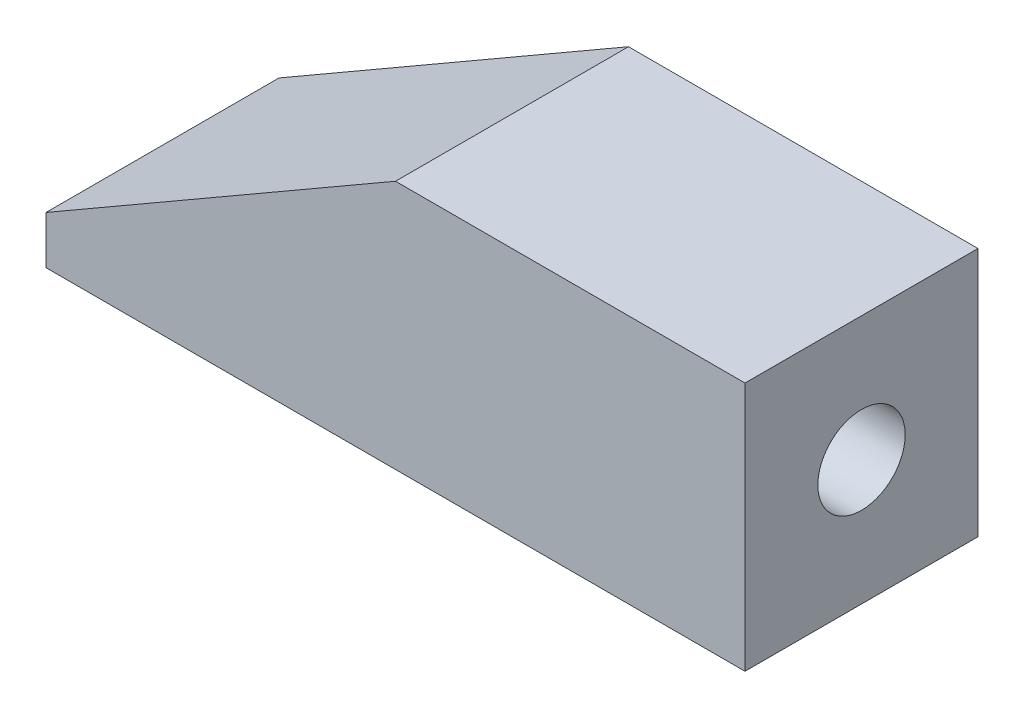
SolidWorks part; units mm, degrees
ref_plane "Plan1" through (0, 0, 0) normal (0, 0, 1) x (1, 0, 0)
ref_plane "Plan2" through (0, 0, 0) normal (0, 1, 0) x (1, 0, 0)
ref_plane "Plan3" through (0, 0, 0) normal (1, 0, 0) x (0, 0, -1)
sketch "Esquisse1" plane through (0, 0, 0) normal (0, 0, 1) x (1, 0, 0)
  line L0 (0, 5.7513) -> (42, 30)
  line L1 (0, 0) -> (84, 0)
  line L2 (0, 0) -> (0, 5.7513)
  line L3 (42, 30) -> (84, 30)
  line L4 (84, 0) -> (84, 30)
  dimension "D1" = 30
  dimension "D2" = 84
  dimension "D3" = 42
  dimension "D4" = 30
extrude "Base-Extrusion" add sketch "Esquisse1" along normal blind 28
hole_wizard "Trou taraudé M12x1.51" positions "Esquisse6" profile "Esquisse5" tap size "M12x1.5" standard "ISO"
sketch "Esquisse6" plane through (84, 0, 0) normal (1, 0, 0) x (0, 0, -1)
  line L0 (-28, 0) -> (0, 0) construction
  line L1 (0, 0) -> (0, 30) construction
  point P0 (-14, 15)
  dimension "D1" = 15
  dimension "D2" = 14
sketch "Esquisse5" plane through (84, 15, 14) normal (0, 1, 0) x (0, 0, -1)
  line L0 (0, 0) -> (0, 34.6545)
  line L1 (0, 34.6545) -> (5.25, 31.5)
  line L2 (5.25, 31.5) -> (5.25, 0)
  line L5 (5.25, 0) -> (0, 0)
  line L10 (0, 34.6545) -> (-5.25, 31.5) construction
  line L11 (0, -6.35) -> (0, 107.95) construction
  dimension "Diamètre du trou pour taraudage" = 10.5
  dimension "Profondeur du trou pour taraudage" = 31.5
  dimension "Angle de pointe" = 118
